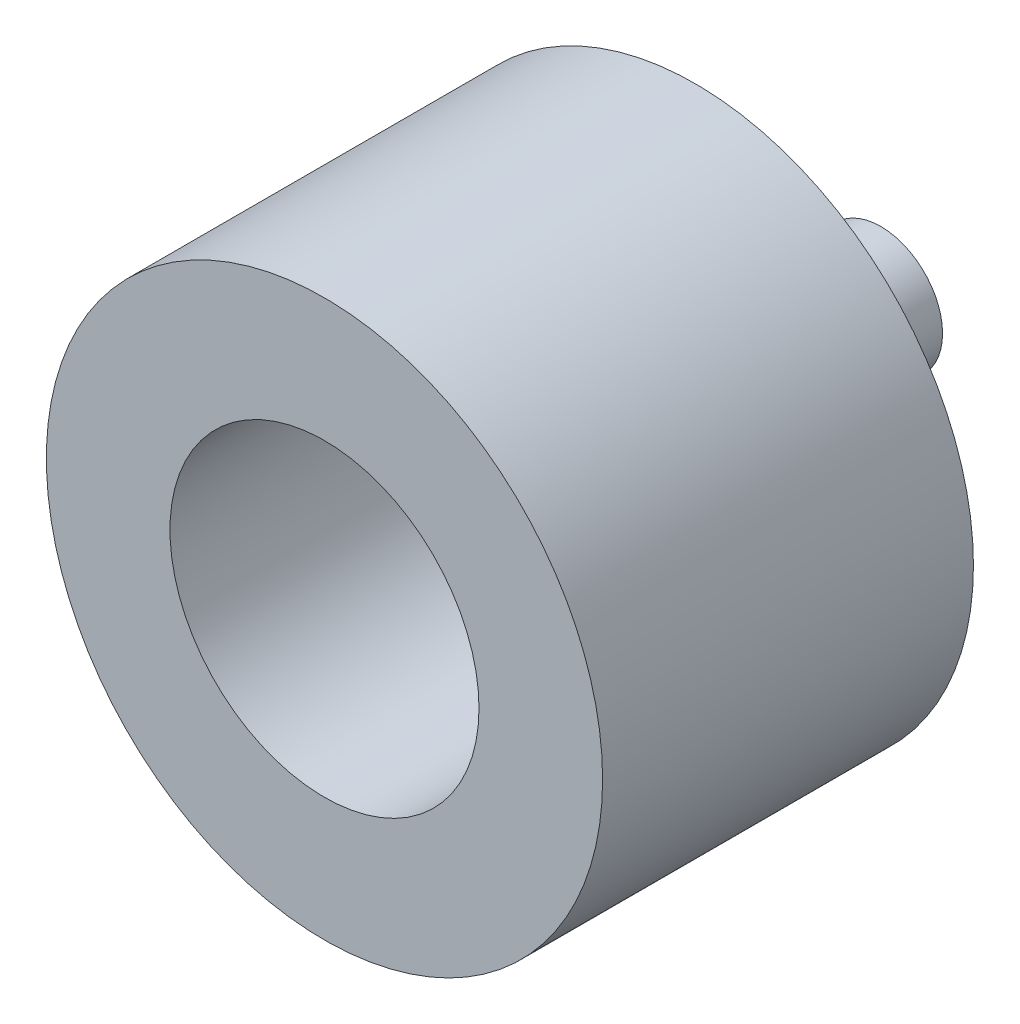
SolidWorks part; units mm, degrees
ref_plane "Alzado" through (0, 0, 0) normal (0, 0, 1) x (1, 0, 0)
ref_plane "Planta" through (0, 0, 0) normal (0, 1, 0) x (1, 0, 0)
ref_plane "Vista lateral" through (0, 0, 0) normal (1, 0, 0) x (0, 0, -1)
sketch "Croquis1" plane through (0, 0, 0) normal (0, 0, 1) x (1, 0, 0)
  circle A0 centre (0, 0) radius 4.5
extrude "Saliente-Extruir1" add sketch "Croquis1" along normal blind 6 contours A0
sketch "Croquis2" plane through (0, 0, 6) normal (0, 0, 1) x (1, 0, 0)
  circle A0 centre (0, 0) radius 2.5
extrude "Cortar-Extruir1" cut sketch "Croquis2" against normal blind 5
sketch "Croquis3" plane through (0, 0, 0) normal (0, 0, -1) x (-1, 0, 0)
  circle A0 centre (0, 0) radius 1
extrude "Saliente-Extruir2" add sketch "Croquis3" along normal blind 3
